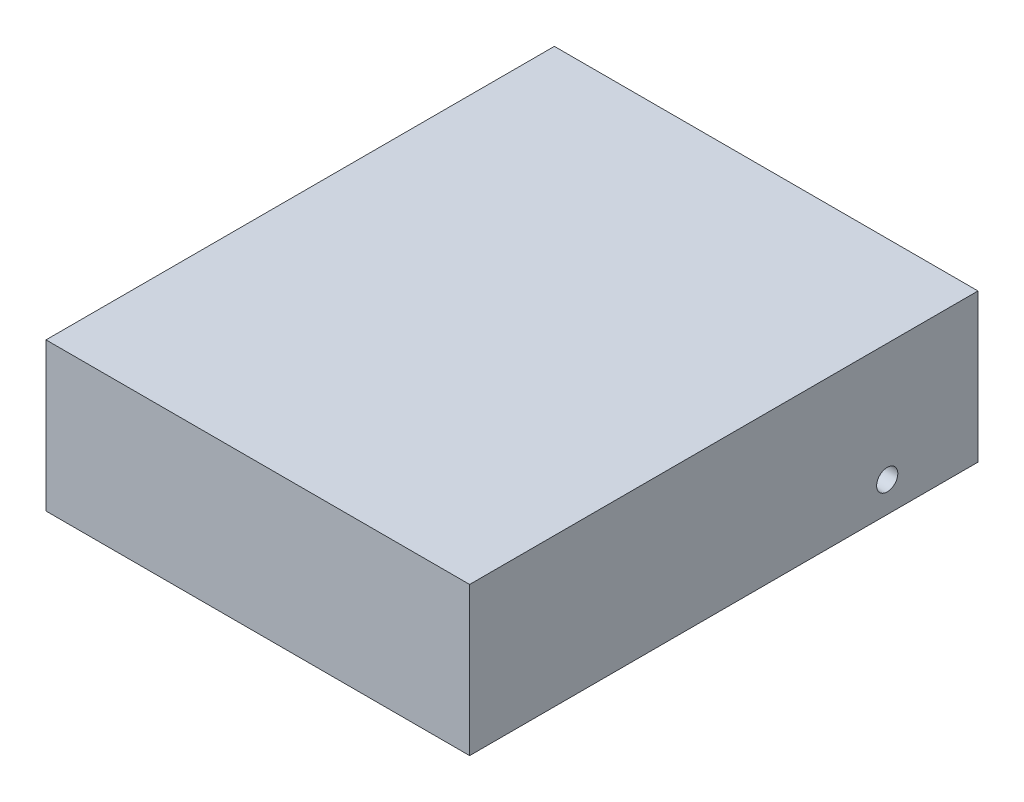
SolidWorks part; units mm, degrees
ref_plane "Front Plane" through (0, 0, 0) normal (0, 0, 1) x (1, 0, 0)
ref_plane "Top Plane" through (0, 0, 0) normal (0, 1, 0) x (1, 0, 0)
ref_plane "Right Plane" through (0, 0, 0) normal (1, 0, 0) x (0, 0, -1)
sketch "Sketch1" plane through (0, 0, 0) normal (0, 0, 1) x (1, 0, 0)
  line L1 (-99.6906, 29.8623) -> (40.3094, 29.8623)
  line L2 (-99.6906, 29.8623) -> (-99.6906, -19.1377)
  line L3 (-99.6906, -19.1377) -> (40.3094, -19.1377)
  line L4 (40.3094, 29.8623) -> (40.3094, -19.1377)
  dimension "D1" = 49
  dimension "D2" = 140
extrude "Boss-Extrude1" add sketch "Sketch1" along normal blind 168
ref_plane "Plane1" through (40.3094, 0, 0) normal (1, 0, 0) x (0, 0, -1)
sketch "Sketch2" plane through (40.3094, 0, 0) normal (1, 0, 0) x (0, 0, -1)
  line L0 (0, -19.1377) -> (0, 29.8623) construction
  line L1 (-168, -19.1377) -> (0, -19.1377) construction
  circle A0 centre (-30, -9.1377) radius 3.5
  dimension "D1" = 7
  dimension "D2" = 30
  dimension "D3" = 10
extrude "Cut-Extrude1" cut sketch "Sketch2" against normal blind 5
